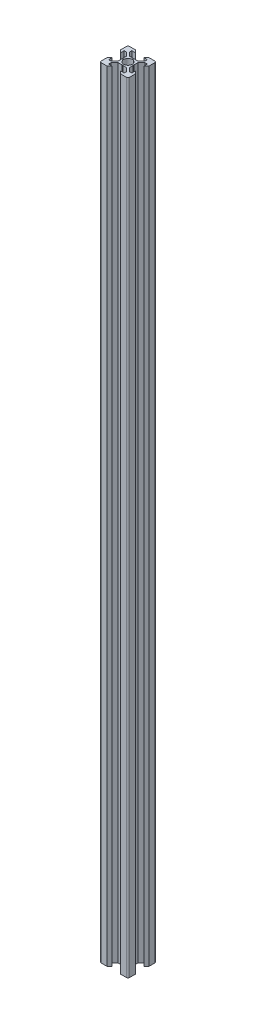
SolidWorks part; units mm, degrees
ref_plane "Front Plane" through (0, 0, 0) normal (0, 0, 1) x (1, 0, 0)
ref_plane "Top Plane" through (0, 0, 0) normal (0, 1, 0) x (1, 0, 0)
ref_plane "Right Plane" through (0, 0, 0) normal (1, 0, 0) x (0, 0, -1)
sketch "Sketch1" plane through (0, 0, 0) normal (0, 1, 0) x (1, 0, 0)
  line L0 (9.9996, -8.9996) -> (9.9996, -4.7998)
  line L1 (9.9996, -4.7998) -> (8.1997, -2.9999)
  line L2 (8.1997, -2.9999) -> (8.1997, -5.4998)
  line L3 (8.1997, -5.4998) -> (6.5604, -5.4998)
  line L4 (6.5604, -5.4998) -> (3.9998, -2.9392)
  line L5 (3.9998, -2.9392) -> (3.9998, -0.3)
  line L6 (3.9998, -0.3) -> (3.6999, 0)
  line L7 (3.6999, 0) -> (3.9998, 0.3)
  line L8 (3.9998, 0.3) -> (3.9998, 2.9392)
  line L9 (3.9998, 2.9392) -> (6.5604, 5.4998)
  line L10 (6.5604, 5.4998) -> (8.1997, 5.4998)
  line L11 (8.1997, 5.4998) -> (8.1997, 2.9999)
  line L12 (8.1997, 2.9999) -> (9.9996, 4.7998)
  line L13 (9.9996, 4.7998) -> (9.9996, 8.9996)
  line L14 (8.9996, 9.9996) -> (4.7998, 9.9996)
  line L15 (4.7998, 9.9996) -> (2.9999, 8.1997)
  line L16 (2.9999, 8.1997) -> (5.4998, 8.1997)
  line L17 (5.4998, 8.1997) -> (5.4998, 6.5604)
  line L18 (5.4998, 6.5604) -> (2.9392, 3.9998)
  line L19 (2.9392, 3.9998) -> (0.3, 3.9998)
  line L20 (0.3, 3.9998) -> (0, 3.6999)
  line L21 (0, 3.6999) -> (-0.3, 3.9998)
  line L22 (-0.3, 3.9998) -> (-2.9392, 3.9998)
  line L23 (-2.9392, 3.9998) -> (-5.4998, 6.5604)
  line L24 (-5.4998, 6.5604) -> (-5.4998, 8.1997)
  line L25 (-5.4998, 8.1997) -> (-2.9999, 8.1997)
  line L26 (-2.9999, 8.1997) -> (-4.7998, 9.9996)
  line L27 (-4.7998, 9.9996) -> (-8.9996, 9.9996)
  line L28 (-9.9996, 8.9996) -> (-9.9996, 4.7998)
  line L29 (-9.9996, 4.7998) -> (-8.1997, 2.9999)
  line L30 (-8.1997, 2.9999) -> (-8.1997, 5.4998)
  line L31 (-8.1997, 5.4998) -> (-6.5604, 5.4998)
  line L32 (-6.5604, 5.4998) -> (-3.9998, 2.9392)
  line L33 (-3.9998, 2.9392) -> (-3.9998, 0.3)
  line L34 (-3.9998, 0.3) -> (-3.6999, 0)
  line L35 (-3.6999, 0) -> (-3.9998, -0.3)
  line L36 (-3.9998, -0.3) -> (-3.9998, -2.9392)
  line L37 (-3.9998, -2.9392) -> (-6.5604, -5.4998)
  line L38 (-6.5604, -5.4998) -> (-8.1997, -5.4998)
  line L39 (-8.1997, -5.4998) -> (-8.1997, -2.9999)
  line L40 (-8.1997, -2.9999) -> (-9.9996, -4.7998)
  line L41 (-9.9996, -4.7998) -> (-9.9996, -8.9996)
  line L42 (-8.9996, -9.9996) -> (-4.7998, -9.9996)
  line L43 (-4.7998, -9.9996) -> (-2.9999, -8.1997)
  line L44 (-2.9999, -8.1997) -> (-5.4998, -8.1997)
  line L45 (-5.4998, -8.1997) -> (-5.4998, -6.5604)
  line L46 (-5.4998, -6.5604) -> (-2.9392, -3.9998)
  line L47 (-2.9392, -3.9998) -> (-0.3, -3.9998)
  line L48 (-0.3, -3.9998) -> (0, -3.6999)
  line L49 (0, -3.6999) -> (0.3, -3.9998)
  line L50 (0.3, -3.9998) -> (2.9392, -3.9998)
  line L51 (2.9392, -3.9998) -> (5.4998, -6.5604)
  line L52 (5.4998, -6.5604) -> (5.4998, -8.1997)
  line L53 (5.4998, -8.1997) -> (2.9999, -8.1997)
  line L54 (2.9999, -8.1997) -> (4.7998, -9.9996)
  line L55 (4.7998, -9.9996) -> (8.9996, -9.9996)
  arc A2 (8.9996, -9.9996) -> (9.9996, -8.9996) centre (8.9996, -8.9996) ccw
  arc A3 (9.9996, 8.9996) -> (8.9996, 9.9996) centre (8.9996, 8.9996) ccw
  arc A4 (-8.9996, 9.9996) -> (-9.9996, 8.9996) centre (-8.9996, 8.9996) ccw
  arc A5 (-9.9996, -8.9996) -> (-8.9996, -9.9996) centre (-8.9996, -8.9996) ccw
  circle A6 centre (0, 0) radius 3
  dimension "D1" = 6
extrude "Boss-Extrude1" add sketch "Sketch1" along normal blind 552
